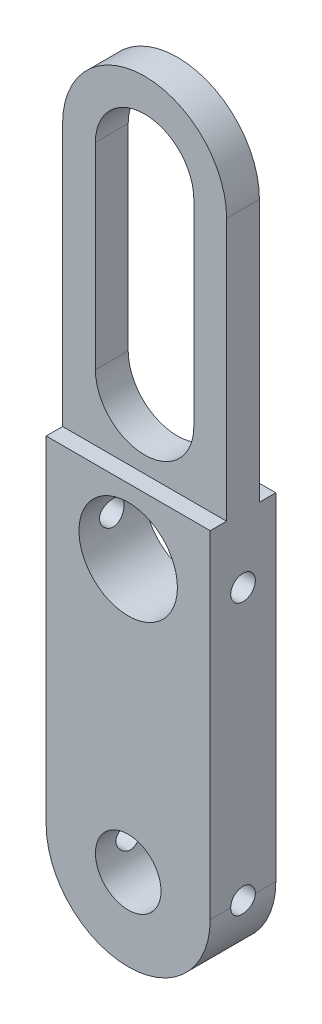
SolidWorks part; units mm, degrees
ref_plane "Front Plane" through (0, 0, 0) normal (0, 0, 1) x (1, 0, 0)
ref_plane "Top Plane" through (0, 0, 0) normal (0, 1, 0) x (1, 0, 0)
ref_plane "Right Plane" through (0, 0, 0) normal (1, 0, 0) x (0, 0, -1)
sketch "Sketch2" plane through (0, 0, 0) normal (0, 0, 1) x (1, 0, 0)
  line L0 (0, 0) -> (0, 52.6585) construction
  line L6 (-4.7625, 31.75) -> (-4.7625, 12.7)
  line L8 (4.7625, 31.75) -> (4.7625, 12.7)
  line L10 (-7.9375, 31.75) -> (-7.9375, -26.2382)
  line L12 (7.9375, 31.75) -> (7.9375, -26.2382)
  line L13 (0, 0) -> (55.9497, 0) construction
  circle A0 centre (0, 0) radius 4.7625
  arc A1 (-4.7625, 12.7) -> (4.7625, 12.7) centre (0, 12.7) ccw
  arc A2 (4.7625, 31.75) -> (-4.7625, 31.75) centre (0, 31.75) ccw
  circle A3 centre (0, -26.2382) radius 3.175
  arc A4 (7.9375, 31.75) -> (-7.9375, 31.75) centre (0, 31.75) ccw
  arc A5 (-7.9375, -26.2382) -> (7.9375, -26.2382) centre (0, -26.2382) ccw
  dimension "D2" = 9.525
  dimension "D6" = 9.525
  dimension "D8" = 6.35
  dimension "D4" = 12.7
  dimension "D5" = 19.05
  dimension "D7" = 26.2382
  dimension "D9" = 15.875
extrude "Extrude1" add sketch "Sketch2" along normal mid plane 6.35
sketch "Sketch3" plane through (0, 0, 0) normal (1, 0, 0) x (0, 0, -1)
  line L1 (1.5875, 44.45) -> (4.7625, 44.45)
  line L2 (1.5875, 44.45) -> (1.5875, 6.35)
  line L3 (1.5875, 6.35) -> (4.7625, 6.35)
  line L4 (4.7625, 44.45) -> (4.7625, 6.35)
  dimension "D1" = 6.35
  dimension "D2" = 38.1
  dimension "D3" = 1.5875
  dimension "D4" = 3.175
extrude "Cut-Extrude1" cut sketch "Sketch3" against normal through all and the other way through all
mirror "Mirror1" about plane through (0, 0, 0) normal (0, 0, 1) of "Cut-Extrude1"
sketch "Sketch4" plane through (0, 0, 0) normal (1, 0, 0) x (0, 0, -1)
  circle A0 centre (0, 0) radius 1.1906
  circle A1 centre (0, -26.2382) radius 1.1906
  dimension "D1" = 2.3813
  dimension "D2" = 26.2382
extrude "Cut-Extrude2" cut sketch "Sketch4" against normal through all and the other way through all
